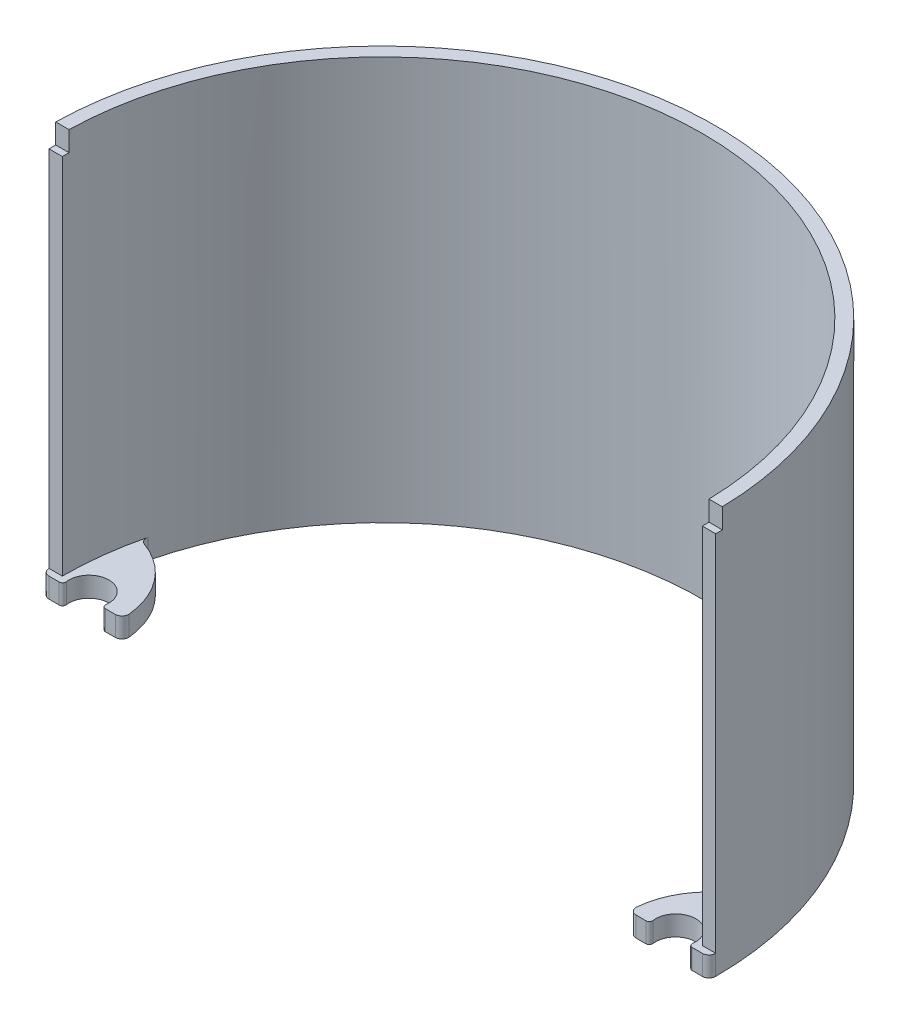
SolidWorks part; units mm, degrees
ref_plane "Front Plane" through (0, 0, 0) normal (0, 0, 1) x (1, 0, 0)
ref_plane "Top Plane" through (0, 0, 0) normal (0, 1, 0) x (1, 0, 0)
ref_plane "Right Plane" through (0, 0, 0) normal (1, 0, 0) x (0, 0, -1)
sketch "Sketch1" plane through (0, 0, 0) normal (0, 1, 0) x (1, 0, 0)
  line L0 (-50, 0) -> (0, 0) construction
  line L1 (0, 0) -> (50, 0) construction
  line L2 (-50, 0) -> (-48, 0)
  line L3 (48, 0) -> (50, 0)
  arc A0 (-48, 0) -> (48, 0) centre (0, 0) cw
  arc A1 (-50, 0) -> (50, 0) centre (0, 0) cw
  dimension "D1" = 50
  dimension "D2" = 2
extrude "Base" add sketch "Sketch1" along normal blind 60.5
sketch "Sketch2" plane through (0, 0, 0) normal (0, -1, 0) x (1, 0, 0)
  line L0 (-48, 0) -> (48, 0) construction
  line L1 (-44, 0) -> (-44, -3) construction
  line L2 (0, 0) -> (0, -47) construction
  line L3 (-46.8284, 1) -> (-49.99, 1)
  line L4 (-48.8733, -10.5544) -> (-46.8253, -10.5544)
  line L5 (-41.1716, 1) -> (-38.01, 1)
  line L6 (44, 0) -> (44, -3) construction
  line L7 (41.1716, 1) -> (38.01, 1)
  line L8 (48.8733, -10.5544) -> (46.8253, -10.5544)
  line L9 (46.8284, 1) -> (49.99, 1)
  circle A0 centre (0, 0) radius 47 construction
  circle A1 centre (-44, 0) radius 3 construction
  arc A2 (-46.8284, 1) -> (-41.1716, 1) centre (-44, 0) ccw
  arc A3 (-49.99, 1) -> (-48.8733, -10.5544) centre (0, 0) ccw
  arc A5 (-50, 0) -> (50, 0) centre (0, 0) ccw construction
  arc A6 (-38.01, 1) -> (-46.8253, -10.5544) centre (-49.99, 1) cw
  circle A7 centre (44, 0) radius 3 construction
  arc A8 (38.01, 1) -> (46.8253, -10.5544) centre (49.99, 1) ccw
  arc A9 (49.99, 1) -> (48.8733, -10.5544) centre (0, 0) cw
  arc A10 (46.8284, 1) -> (41.1716, 1) centre (44, 0) cw
  arc A11 (-48, 0) -> (48, 0) centre (0, 0) ccw construction
  dimension "D1" = 94
  dimension "D2" = 6
  dimension "D3" = 1
extrude "Clip" add sketch "Sketch2" against normal blind 3
fillet "Fillet3" radius 1 6 edges at (46.8253, 1.5, -10.5544) (38.01, 1.5, 1) (49.99, 1.5, 1) (-46.8253, 1.5, -10.5544) (-38.01, 1.5, 1) (-49.99, 1.5, 1)
fillet "Fillet4" radius 0.5 4 edges at (-46.8284, 1.5, 1) (-41.1716, 1.5, 1) (41.1716, 1.5, 1) (46.8284, 1.5, 1)
sketch "Sketch4" plane through (0, 60.5, 0) normal (0, 1, 0) x (1, 0, 0)
  line L1 (50, 0) -> (-50, 0)
  line L2 (50, 0) -> (50, 1)
  line L3 (50, 1) -> (-50, 1)
  line L4 (-50, 0) -> (-50, 1)
  dimension "D1" = 1
extrude "Cut-Extrude3" cut sketch "Sketch4" against normal blind 3
equation "\"D1@Sketch1\"=\"base diameter@values@params.sldprt\"/2"
equation "\"D1@Sketch2\"=\"base diameter@values@params.sldprt\"-2*\"width keep@values@params.sldprt\""
equation "\"D2@Sketch2\"=2*\"width keep@values@params.sldprt\""
